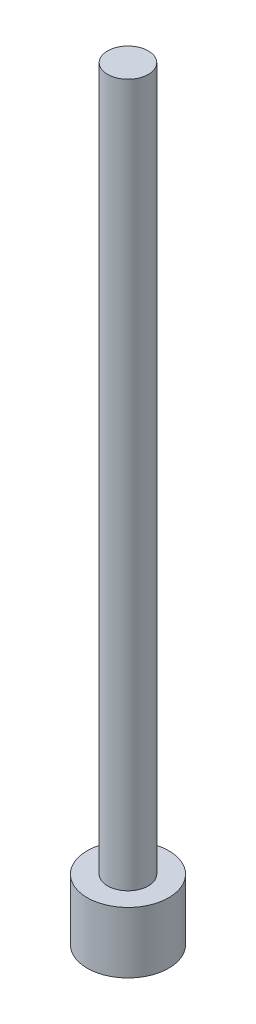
SolidWorks part; units mm, degrees
ref_plane "Plan de face" through (0, 0, 0) normal (0, 0, 1) x (1, 0, 0)
ref_plane "Plan de dessus" through (0, 0, 0) normal (0, 1, 0) x (1, 0, 0)
ref_plane "Plan de droite" through (0, 0, 0) normal (1, 0, 0) x (0, 0, -1)
sketch "Esquisse1" plane through (0, 0, 0) normal (0, 1, 0) x (1, 0, 0)
  circle A0 centre (0, 0) radius 2
  dimension "D1" = 4
extrude "Extrusion1" add sketch "Esquisse1" along normal blind 3
sketch "Esquisse2" plane through (0, 3, 0) normal (0, 1, 0) x (-1, 0, 0)
  circle A0 centre (0, 0) radius 1
  dimension "D1" = 2
extrude "Extrusion2" add sketch "Esquisse2" along normal blind 34.5
